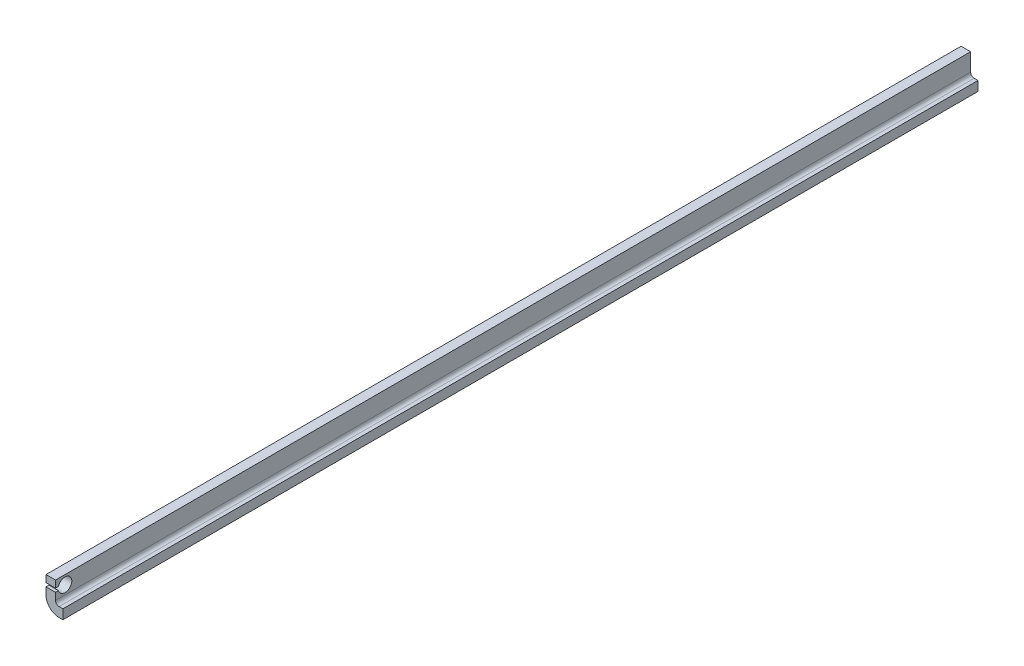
SolidWorks part; units mm, degrees
ref_plane "Face" through (0, 0, 0) normal (0, 0, 1) x (1, 0, 0)
ref_plane "Dessus" through (0, 0, 0) normal (0, 1, 0) x (1, 0, 0)
ref_plane "Droite" through (0, 0, 0) normal (1, 0, 0) x (0, 0, -1)
sketch "Esquisse1" plane through (0, 0, 0) normal (0, 0, 1) x (1, 0, 0)
  line L6 (-1.0883, -5.1216) -> (-2.1417, -5.1216)
  line L7 (-2.1417, -5.1216) -> (-2.1417, -7.0742)
  line L8 (-0.6984, -8.5175) -> (-0.2735, -8.5175)
  line L9 (-0.2735, -8.5175) -> (-0.2735, -7.4641)
  line L10 (-0.2735, -7.4641) -> (-0.6984, -7.4641)
  line L11 (-1.0883, -7.0742) -> (-1.0883, -5.1216)
  line L12 (-1.0883, -5.1216) -> (-2.1417, -5.1216)
  line L13 (-2.1417, -5.1216) -> (-2.1417, -7.0742)
  line L14 (-0.6984, -8.5175) -> (-0.2735, -8.5175)
  line L15 (-0.2735, -8.5175) -> (-0.2735, -7.4641)
  line L16 (-0.2735, -7.4641) -> (-0.6984, -7.4641)
  line L17 (-1.0883, -7.0742) -> (-1.0883, -5.1216)
  arc A2 (-2.1417, -7.0742) -> (-0.6984, -8.5175) centre (-0.6984, -7.0742) ccw
  arc A3 (-1.0883, -7.0742) -> (-0.6984, -7.4641) centre (-0.6984, -7.0742) ccw
  arc A4 (-2.1417, -7.0742) -> (-0.6984, -8.5175) centre (-0.6984, -7.0742) ccw
  arc A5 (-1.0883, -7.0742) -> (-0.6984, -7.4641) centre (-0.6984, -7.0742) ccw
  dimension "D1" = 0
extrude "Longueur" add sketch "Esquisse1" along normal up to surface (101.1243 mm away)
sketch "Esquisse2" plane through (-2.1417, 0, 0) normal (-1, 0, 0) x (0, 0, 1)
  line L0 (101.1243, -6.0979) -> (98.9883, -6.0979) construction
  line L1 (101.1243, -5.1216) -> (101.1243, -7.0742) construction
  line L2 (100.7971, -5.8979) -> (101.1243, -5.8979)
  line L3 (100.7971, -6.2979) -> (101.1243, -6.2979)
  line L4 (101.1243, -5.8979) -> (101.1243, -6.2979)
  arc A0 (100.7971, -5.8979) -> (100.7971, -6.2979) centre (100.0743, -6.0979) ccw
  dimension "D1" = 1.5
  dimension "D2" = 1.05
  dimension "D3" = 0.4
extrude "Trou pour goupille" cut sketch "Esquisse2" against normal through all
